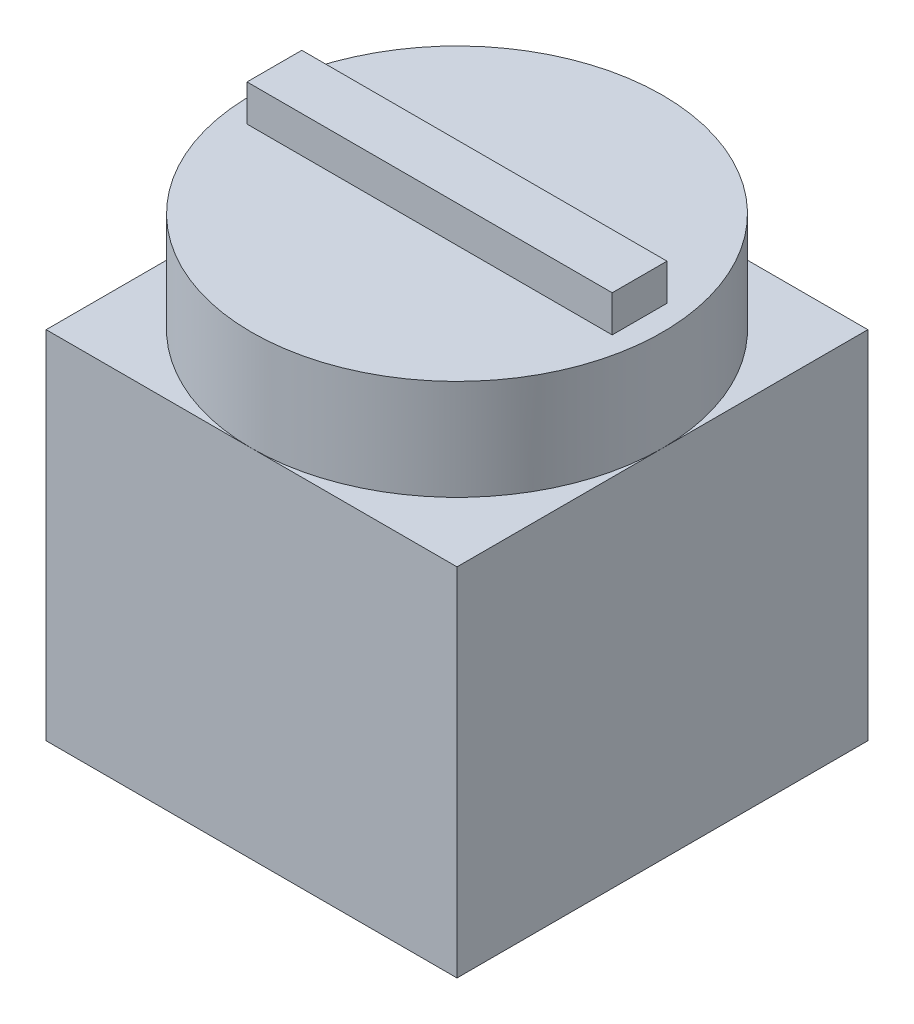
SolidWorks part; units mm, degrees
ref_plane "Plan de face" through (0, 0, 0) normal (0, 0, 1) x (1, 0, 0)
ref_plane "Plan de dessus" through (0, 0, 0) normal (0, 1, 0) x (1, 0, 0)
ref_plane "Plan de droite" through (0, 0, 0) normal (1, 0, 0) x (0, 0, -1)
sketch "Esquisse1" plane through (0, 0, 0) normal (0, 1, 0) x (1, 0, 0)
  line L1 (-4.5, 4.5) -> (4.5, 4.5)
  line L2 (-4.5, 4.5) -> (-4.5, -4.5)
  line L3 (-4.5, -4.5) -> (4.5, -4.5)
  line L4 (4.5, 4.5) -> (4.5, -4.5)
  line L5 (-4.5, 4.5) -> (4.5, -4.5) construction
  line L6 (-4.5, -4.5) -> (4.5, 4.5) construction
  point P0 (0, 0)
  dimension "D1" = 9
  dimension "D2" = 9
extrude "Boss.-Extru.1" add sketch "Esquisse1" along normal blind 7.8
sketch "Esquisse2" plane through (0, 7.8, 0) normal (0, 1, 0) x (1, 0, 0)
  circle A0 centre (0, 0) radius 4.5
extrude "Boss.-Extru.2" add sketch "Esquisse2" along normal blind 2.2
sketch "Esquisse3" plane through (0, 10, 0) normal (0, 1, 0) x (1, 0, 0)
  line L1 (-0.6, 4) -> (0.6, 4)
  line L2 (-0.6, 4) -> (-0.6, -4)
  line L3 (-0.6, -4) -> (0.6, -4)
  line L4 (0.6, 4) -> (0.6, -4)
  line L5 (-0.6, 4) -> (0.6, -4) construction
  line L6 (-0.6, -4) -> (0.6, 4) construction
  line L7 (-4, 0.6) -> (4, 0.6)
  line L8 (-4, 0.6) -> (-4, -0.6)
  line L9 (-4, -0.6) -> (4, -0.6)
  line L10 (4, 0.6) -> (4, -0.6)
  line L11 (-4, 0.6) -> (4, -0.6) construction
  line L12 (-4, -0.6) -> (4, 0.6) construction
  point P0 (0, 0)
  point P8 (0, 0)
  dimension "D1" = 1.2
  dimension "D2" = 1.2
  dimension "D3" = 8
  dimension "D4" = 8
extrude "Boss.-Extru.3" add sketch "Esquisse3" along normal blind 0.8 contours L8 L9 L2 L7 | L2 L9 L4 L7 | L10 L7 L4 L9
